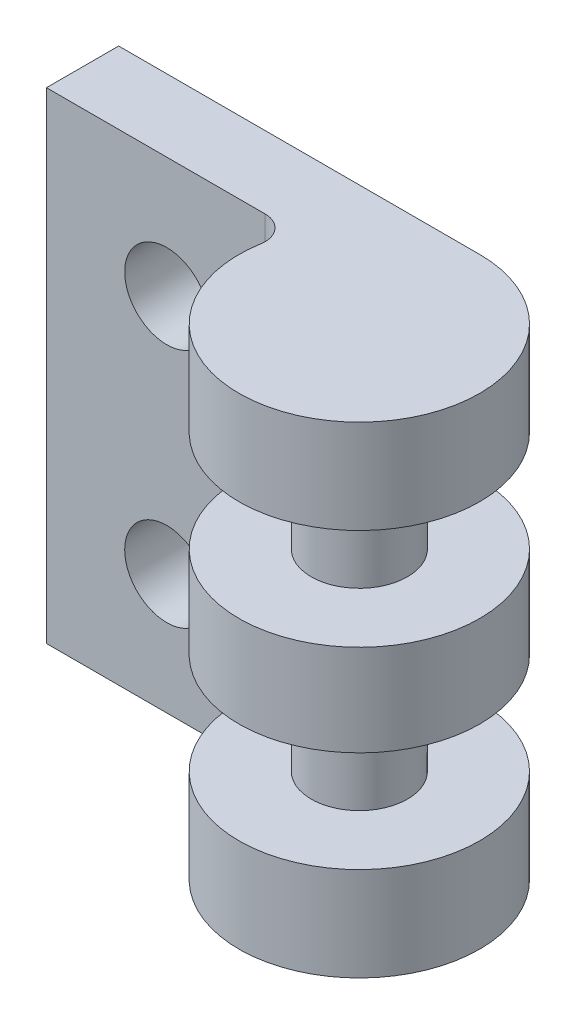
SolidWorks part; units mm, degrees
ref_plane "Alzado" through (0, 0, 0) normal (0, 0, 1) x (1, 0, 0)
ref_plane "Planta" through (0, 0, 0) normal (0, 1, 0) x (1, 0, 0)
ref_plane "Vista lateral" through (0, 0, 0) normal (1, 0, 0) x (0, 0, -1)
sketch "Sketch1" plane through (0, 0, 0) normal (0, 0, 1) x (1, 0, 0)
  line L0 (0, 0) -> (5, 0) construction
  line L1 (-5, -10) -> (5, -10)
  line L2 (-5, -10) -> (-5, 10)
  line L3 (-5, 10) -> (5, 10)
  line L4 (5, -10) -> (5, 10)
  line L5 (-5, -10) -> (5, 10) construction
  line L6 (-5, 10) -> (5, -10) construction
  line L7 (0, 0) -> (0, 5) construction
  circle A0 centre (0, 5) radius 1.75
  circle A1 centre (0, -5) radius 1.75
  point P0 (0, 0)
  dimension "D4" = 3.5
  dimension "D1" = 10
  dimension "D2" = 20
  dimension "D3" = 5
extrude "Boss-Extrude1" add sketch "Sketch1" along normal blind 3
sketch "Sketch2" plane through (0, 0, 0) normal (0, 1, 0) x (1, 0, 0)
  line L0 (0, 0) -> (10, 0) construction
  line L1 (10, 0) -> (15, 0) construction
  line L2 (5, -3) -> (5.4174, -3)
  line L5 (5, -3) -> (5, 0) construction
  line L6 (5, 0) -> (5, -3)
  line L7 (15, 0) -> (15, -5) construction
  line L8 (5, 0) -> (10, 0)
  line L9 (5, -3) -> (-5, -3) construction
  arc A2 (5.4174, -3) -> (10, 0) centre (10, -5) ccw
  point P2 (2.3604, -1.5)
  point P9 (2.3668, -1.5)
  point P10 (8, -2.5046)
  point P15 (-4, 0)
  point P17 (0, 0)
  point P18 (14.8015, 0)
  point P19 (6.4293, -1.5)
  point P20 (0, 0)
  dimension "D3" = 5
  dimension "D1" = 10
  dimension "D2" = 5
extrude "Boss-Extrude2" add sketch "Sketch2" along normal mid plane 20
sketch "Sketch3" plane through (0, 0, 3) normal (0, 0, 1) x (1, 0, 0)
  line L1 (5, 6.1) -> (15, 6.1)
  line L2 (5, 6.1) -> (5, 1.9)
  line L3 (5, 1.9) -> (15, 1.9)
  line L4 (15, 6.1) -> (15, 1.9)
  line L5 (15, -10) -> (15, 10) construction
  line L6 (0, 0) -> (15, 0) construction
  line L7 (5, -1.9) -> (15, -1.9)
  line L8 (15, -6.1) -> (15, -1.9)
  line L9 (5, -6.1) -> (15, -6.1)
  line L10 (5, -6.1) -> (5, -1.9)
  line L12 (5, 10) -> (5, -10) construction
  point P15 (0, 0)
  dimension "D1" = 4.2
  dimension "D2" = 1.9
extrude "Cut-Extrude1" cut sketch "Sketch3" against normal mid plane 20
sketch "Sketch4" plane through (0, 0, 0) normal (0, 1, 0) x (1, 0, 0)
  circle A0 centre (10, -5) radius 2
  dimension "D1" = 4
extrude "Boss-Extrude3" add sketch "Sketch4" along normal mid plane 20
fillet "Fillet1" radius 1 2 edges at (5, -4, 3) (5, 4, 3)
fillet "Fillet2" radius 1 3 edges at (5.4174, -8.05, 3) (5.4174, 0, 3) (5.4174, 8.05, 3)
